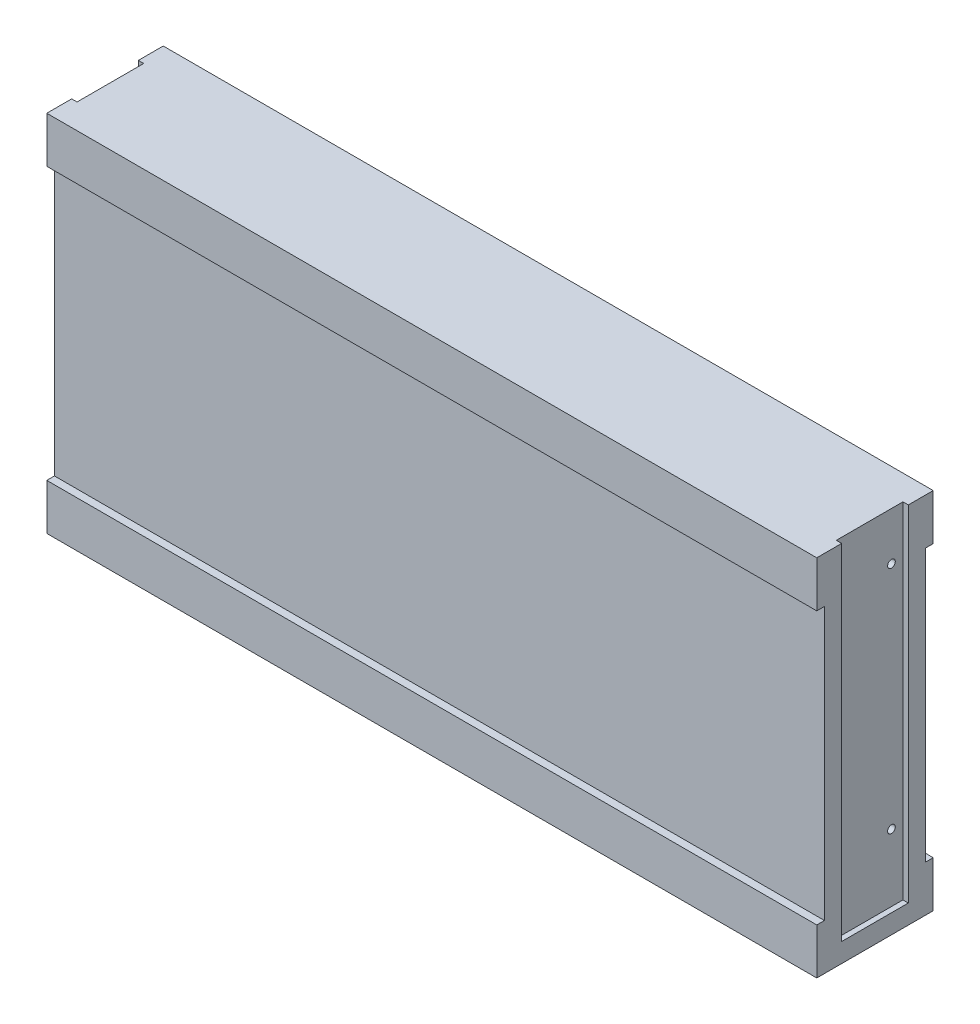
SolidWorks part; units mm, degrees
ref_plane "Front Plane" through (0, 0, 0) normal (0, 0, 1) x (1, 0, 0)
ref_plane "Top Plane" through (0, 0, 0) normal (0, 1, 0) x (1, 0, 0)
ref_plane "Right Plane" through (0, 0, 0) normal (1, 0, 0) x (0, 0, -1)
sketch "Sketch1" plane through (0, 0, 0) normal (0, 0, 1) x (1, 0, 0)
  line L1 (-136.4512, 43.1006) -> (64.5488, 43.1006)
  line L2 (-136.4512, 43.1006) -> (-136.4512, -51.8994)
  line L3 (-136.4512, -51.8994) -> (64.5488, -51.8994)
  line L4 (64.5488, 43.1006) -> (64.5488, -51.8994)
  dimension "D1" = 201
  dimension "D2" = 95
extrude "Boss-Extrude1" add sketch "Sketch1" along normal blind 30.4
ref_plane "Plane1" through (64.5488, 0, 0) normal (1, 0, 0) x (0, 0, -1)
sketch "Sketch2" plane through (64.5488, 0, 0) normal (1, 0, 0) x (0, 0, -1)
  line L0 (-30.4, -51.8994) -> (0, -51.8994) construction
  line L2 (0, -51.8994) -> (0, 43.1006) construction
  circle A0 centre (-9.5, -29.3994) radius 1
  circle A1 centre (-9.5, 30.6006) radius 1
  dimension "D1" = 2
  dimension "D3" = 60
  dimension "D4" = 2
  dimension "D2" = 22.5
  dimension "D5" = 9.5
  dimension "D6" = 9.5
extrude "Cut-Extrude1" cut sketch "Sketch2" against normal up to surface (201 mm away)
ref_plane "Plane2" through (-136.4512, 0, 0) normal (-1, 0, 0) x (0, 0, 1)
sketch "Sketch5" plane through (64.5488, 0, 0) normal (1, 0, 0) x (0, 0, -1)
  line L0 (-30.4, -51.8994) -> (-30.4, 43.1006) construction
  line L1 (-30.4, -39.8994) -> (-28.4, -39.8994)
  line L2 (-30.4, -39.8994) -> (-30.4, 31.1006)
  line L3 (-30.4, 31.1006) -> (-28.4, 31.1006)
  line L4 (-28.4, -39.8994) -> (-28.4, 31.1006)
  line L5 (0, -51.8994) -> (0, 43.1006) construction
  line L6 (0, -39.8994) -> (-2, -39.8994)
  line L7 (0, -39.8994) -> (0, 31.1006)
  line L8 (0, 31.1006) -> (-2, 31.1006)
  line L9 (-2, -39.8994) -> (-2, 31.1006)
  line L10 (-30.4, -51.8994) -> (0, -51.8994) construction
  line L11 (-30.4, 43.1006) -> (0, 43.1006) construction
  point P14 (-29.4, -39.8994)
  point P17 (-1, 31.1006)
  dimension "D1" = 2
  dimension "D2" = 12
  dimension "D3" = 2
  dimension "D4" = 12
  dimension "D5" = 12
  dimension "D6" = 12
extrude "Cut-Extrude4" cut sketch "Sketch5" against normal up to surface (201 mm away)
sketch "Sketch4" plane through (-136.4512, 0, 0) normal (-1, 0, 0) x (0, 0, 1)
  line L0 (30.4, 43.1006) -> (0, 43.1006) construction
  line L1 (23.9, 43.1006) -> (6.5, 43.1006)
  line L2 (23.9, 43.1006) -> (23.9, -46.8994)
  line L3 (23.9, -46.8994) -> (6.5, -46.8994)
  line L4 (6.5, 43.1006) -> (6.5, -46.8994)
  line L6 (30.4, -51.8994) -> (0, -51.8994) construction
  line L10 (28.4, -39.8994) -> (28.4, 31.1006) construction
  line L11 (2, 31.1006) -> (2, -39.8994) construction
  point P4 (0, 0)
  point P5 (23.2251, 42.9376)
  point P7 (22.2985, 43.1006)
  point P10 (28.3964, -46.8994)
  dimension "D1" = 4.5
  dimension "D2" = 5
  dimension "D3" = 4.5
sketch "Sketch3" plane through (64.5488, 0, 0) normal (1, 0, 0) x (0, 0, -1)
  line L0 (-30.4, 43.1006) -> (0, 43.1006) construction
  line L1 (-23.9, -46.8994) -> (-6.5, -46.8994)
  line L2 (-23.9, -46.8994) -> (-23.9, 43.1006)
  line L3 (-23.9, 43.1006) -> (-6.5, 43.1006)
  line L4 (-6.5, -46.8994) -> (-6.5, 43.1006)
  point P6 (-24.4, -46.8994)
  point P7 (-6, -46.8994)
extrude "Cut-Extrude5" cut sketch "Sketch4" against normal blind 1.4
extrude "Cut-Extrude6" cut sketch "Sketch3" against normal blind 1.4
